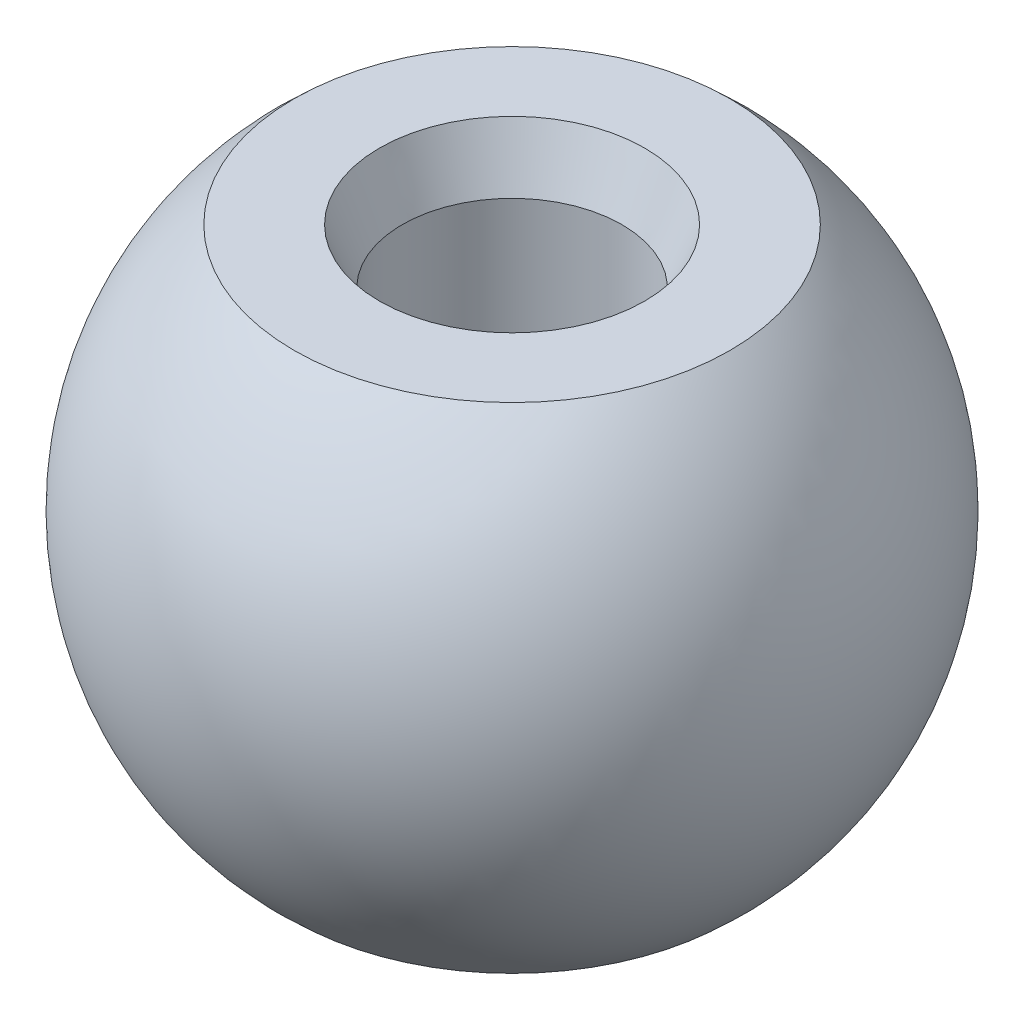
SolidWorks part; units mm, degrees
ref_plane "Front Plane" through (0, 0, 0) normal (0, 0, 1) x (1, 0, 0)
ref_plane "Top Plane" through (0, 0, 0) normal (0, 1, 0) x (1, 0, 0)
ref_plane "Right Plane" through (0, 0, 0) normal (1, 0, 0) x (0, 0, -1)
sketch "Sketch1" plane through (0, 0, 0) normal (0, 1, 0) x (1, 0, 0)
  line L0 (0, 6) -> (0, -6)
  arc A0 (0, 6) -> (0, -6) centre (0, 0) ccw
  dimension "D1" = 6
revolve "Revolve1" add sketch "Sketch1" angle 360 about L0
ref_plane "Plane1" through (0, 4.5, 0) normal (0, 1, 0) x (-1, 0, 0)
sketch "Sketch2" plane through (0, 4.5, 0) normal (0, 1, 0) x (-1, 0, 0)
  line L1 (-6, 6) -> (6, 6)
  line L2 (-6, 6) -> (-6, -6)
  line L3 (-6, -6) -> (6, -6)
  line L4 (6, 6) -> (6, -6)
  circle A0 centre (0, 0) radius 6 construction
extrude "Extrude1" cut sketch "Sketch2" along normal blind 20
mirror "Mirror1" about plane through (0, 0, 0) normal (0, 1, 0) of "Extrude1"
sketch "Sketch3" plane through (0, 0, 0) normal (0, 0, 1) x (1, 0, 0)
  line L0 (0, -4.5) -> (0, 6.5472) construction
  line L1 (-3.9686, -4.5) -> (3.9686, -4.5) construction
  line L2 (0, -4.5) -> (-2, -4.5)
  line L3 (-2, -4.5) -> (-2, 3.5)
  line L4 (-2, 3.5) -> (-2.4142, 4.5)
  line L5 (3.9686, 4.5) -> (-3.9686, 4.5) construction
  line L6 (-2.4142, 4.5) -> (0, 4.5)
  line L7 (0, 4.5) -> (0, -4.5)
  dimension "D1" = 4
  dimension "D2" = 1
  dimension "D3" = 22.5
revolve "Cut-Revolve1" cut sketch "Sketch3" angle 360 about L0
